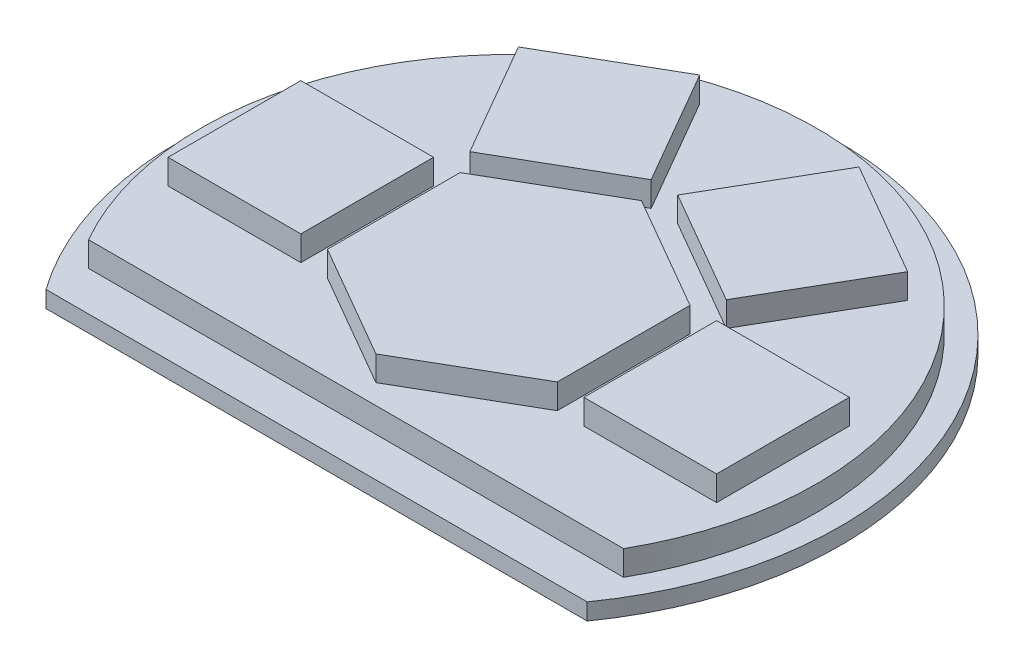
SolidWorks part; units mm, degrees
ref_plane "Front Plane" through (0, 0, 0) normal (0, 0, 1) x (1, 0, 0)
ref_plane "Top Plane" through (0, 0, 0) normal (0, 1, 0) x (1, 0, 0)
ref_plane "Right Plane" through (0, 0, 0) normal (1, 0, 0) x (0, 0, -1)
sketch "Sketch1" plane through (0, 0, 0) normal (0, 1, 0) x (1, 0, 0)
  line L0 (0, 50.8) -> (0, -50.8) construction
  line L1 (0, 50.8) -> (-43.9941, 25.4)
  line L2 (-43.9941, 25.4) -> (-43.9941, -25.4)
  line L3 (-43.9941, -25.4) -> (0, -50.8)
  line L4 (0, -50.8) -> (43.9941, -25.4)
  line L5 (43.9941, -25.4) -> (43.9941, 25.4)
  line L6 (43.9941, 25.4) -> (0, 50.8)
  line L7 (-54.1541, 25.4) -> (-104.9541, 25.4)
  line L8 (-54.1541, 25.4) -> (-54.1541, -25.4)
  line L9 (-54.1541, -25.4) -> (-104.9541, -25.4)
  line L10 (-104.9541, 25.4) -> (-104.9541, -25.4)
  line L11 (104.9541, 25.4) -> (104.9541, -25.4)
  line L12 (54.1541, -25.4) -> (104.9541, -25.4)
  line L13 (54.1541, 25.4) -> (54.1541, -25.4)
  line L14 (54.1541, 25.4) -> (104.9541, 25.4)
  line L15 (30.48, 103.5929) -> (5.08, 59.5988)
  line L16 (-74.4741, 78.1929) -> (-30.48, 103.5929)
  line L17 (-74.4741, 78.1929) -> (-49.0741, 34.1988)
  line L18 (-49.0741, 34.1988) -> (-5.08, 59.5988)
  line L19 (-30.48, 103.5929) -> (-5.08, 59.5988)
  line L20 (49.0741, 34.1988) -> (5.08, 59.5988)
  line L21 (74.4741, 78.1929) -> (49.0741, 34.1988)
  line L22 (74.4741, 78.1929) -> (30.48, 103.5929)
  circle A0 centre (0, 0) radius 43.9941 construction
  dimension "D1" = 50.8
  dimension "D2" = 50.8
  dimension "D3" = 10.16
  dimension "D4" = 50.8
  dimension "D5" = 50.8
  dimension "D6" = 10.16
  dimension "D7" = 0
extrude "pawprint" add sketch "Sketch1" along normal blind 25.4
sketch "Sketch2" plane through (0, 0, 0) normal (0, -1, 0) x (1, 0, 0)
  line L0 (102.3815, 58.42) -> (-102.3815, 58.42)
  circle A0 centre (0, 0) radius 117.8765
  dimension "D1" = 58.42
extrude "plate" add sketch "Sketch2" against normal blind 15.875 contours L0 A0 M2 M7 M6 M5 M4 M3
sketch "Sketch3" plane through (0, 0, 0) normal (0, -1, 0) x (1, 0, 0)
  line L0 (-103.5523, 73.525) -> (103.5523, 73.525)
  circle A0 centre (0, 0) radius 127
  dimension "D1" = 254
extrude "millbase" add sketch "Sketch3" against normal blind 6.35 contours L0 A0 M1 M2
